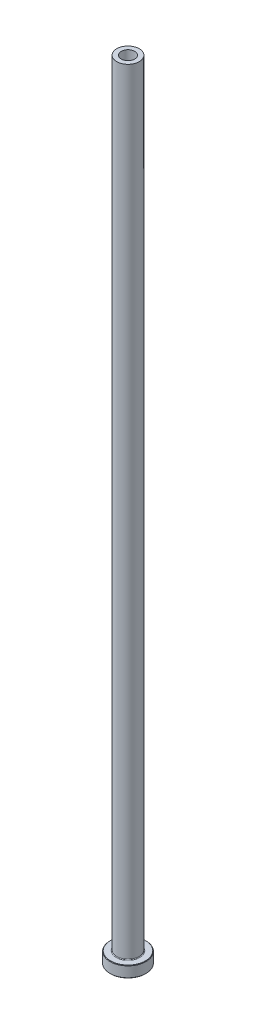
SolidWorks part; units mm, degrees
ref_plane "Front Plane" through (0, 0, 0) normal (0, 0, 1) x (1, 0, 0)
ref_plane "Top Plane" through (0, 0, 0) normal (0, 1, 0) x (1, 0, 0)
ref_plane "Right Plane" through (0, 0, 0) normal (1, 0, 0) x (0, 0, -1)
sketch "Sketch1" plane through (0, 0, 0) normal (0, 0, 1) x (1, 0, 0)
  line L0 (-3, 350) -> (-5, 350)
  line L1 (-5, 350) -> (-5, 5)
  line L2 (-5, 5) -> (-8, 5)
  line L3 (-8, 5) -> (-8, 0)
  line L4 (8.8, 0) -> (-8.8, 0) construction
  line L5 (-8, 0) -> (-3.25, 0)
  line L6 (-3, 305) -> (-3, 350)
  line L7 (0, 92.1877) -> (0, -15.5353) construction
  line L8 (0, -8.8) -> (0, 8.8) construction
  line L9 (-3, 305) -> (-3.25, 293)
  line L10 (-3.25, 293) -> (-3.25, 0)
  dimension "D1" = 0.25
  dimension "ID" = 6
  dimension "OD" = 10
  dimension "L" = 350
  dimension "H" = 16
  dimension "T" = 5
  dimension "N" = 45
  dimension "D2" = 12
revolve "Revolve1" add sketch "Sketch1" angle 360 about L7
fillet "Fillet1" radius 0.3 1 edges at (0, 5, 5)
chamfer "Chamfer1" distance 0.2 angle 45 2 edges at (0, 5, 8) (0, 0, 8)
chamfer "Chamfer3" distance 0.5 angle 45 1 edges at (0, 0, 3.25)
